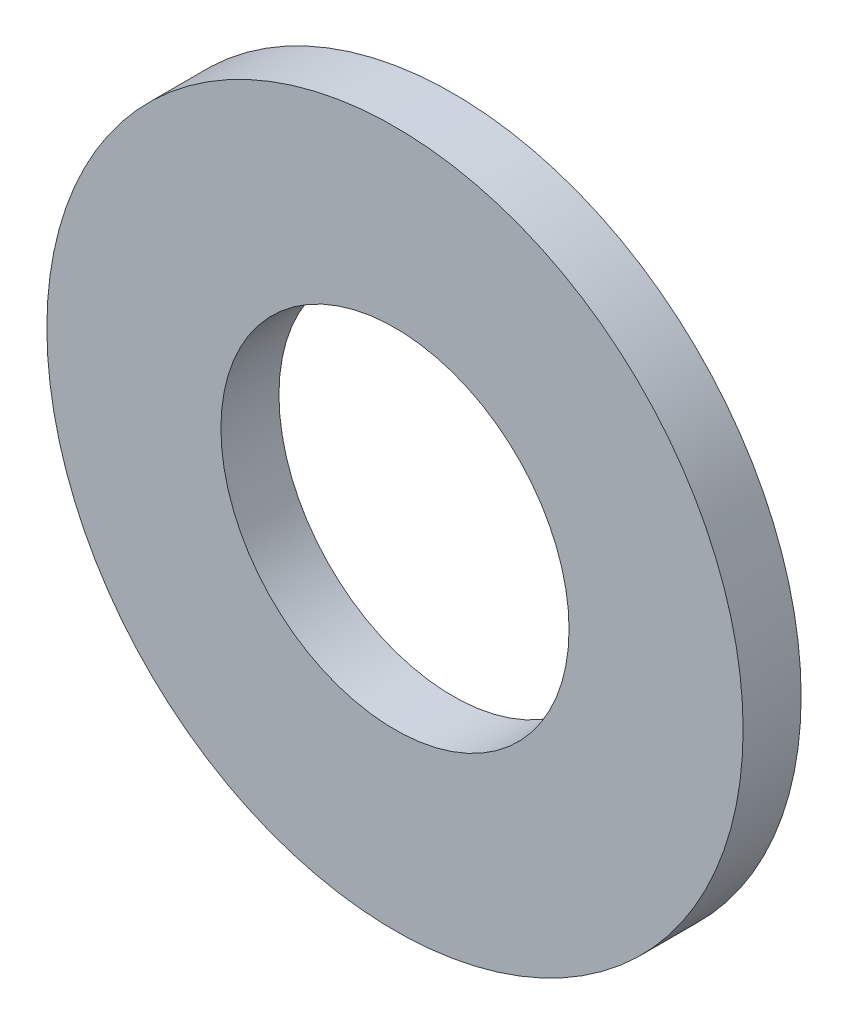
SolidWorks part; units mm, degrees
ref_plane "Plan de face" through (0, 0, 0) normal (0, 0, 1) x (1, 0, 0)
ref_plane "Plan de dessus" through (0, 0, 0) normal (0, 1, 0) x (1, 0, 0)
ref_plane "Plan de droite" through (0, 0, 0) normal (1, 0, 0) x (0, 0, -1)
sketch "Esquisse1" plane through (0, 0, 0) normal (0, 1, 0) x (1, 0, 0)
  line L0 (4.5, -1.5) -> (9, -1.5)
  line L1 (9, -1.5) -> (9, 0)
  line L2 (9, 0) -> (4.5, 0)
  line L3 (4.5, 0) -> (4.5, -1.5)
  line L4 (0, 0) -> (0, -1.5) construction
revolve "Révolution1" add sketch "Esquisse1" angle 360 about L4
